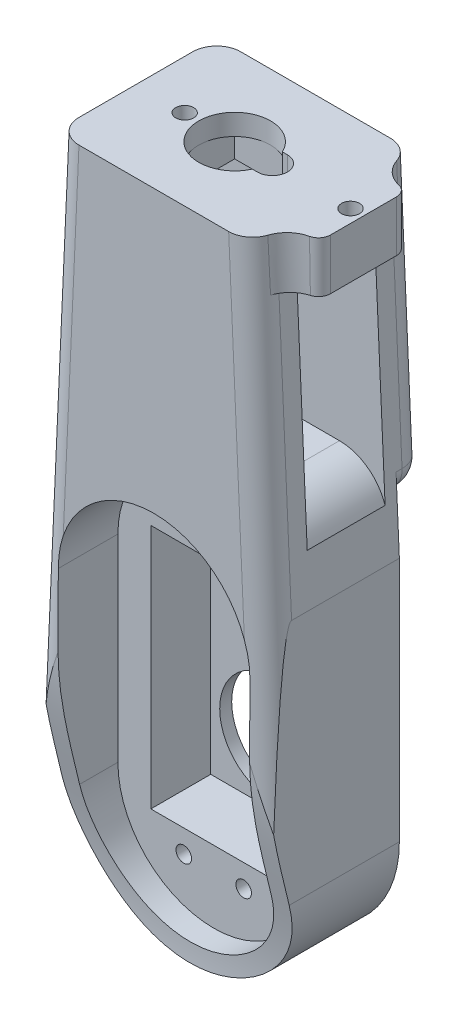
SolidWorks part; units mm, degrees
ref_plane "前视基准面" through (0, 0, 0) normal (0, 0, 1) x (1, 0, 0)
ref_plane "上视基准面" through (0, 0, 0) normal (0, 1, 0) x (1, 0, 0)
ref_plane "右视基准面" through (0, 0, 0) normal (1, 0, 0) x (0, 0, -1)
imported_body "输入1"
sketch "草图1" plane through (0, 0, 19) normal (0, 0, 1) x (1, 0, 0)
  line L1 (9.5445, 46.7241) -> (-8.7751, 46.7241)
  line L2 (9.5445, 46.7241) -> (9.5445, 16.1197)
  line L3 (9.5445, 16.1197) -> (-8.7751, 16.1197)
  line L4 (-8.7751, 46.7241) -> (-8.7751, 16.1197)
  line L5 (9.5445, 46.7241) -> (-8.7751, 16.1197) construction
  line L6 (9.5445, 16.1197) -> (-8.7751, 46.7241) construction
  point P4 (0.3847, 31.4219)
extrude "凸台-拉伸1" add sketch "草图1" against normal up to surface (7 mm away)
sketch "草图2" plane through (0, 46.5, 0) normal (0, -1, 0) x (1, 0, 0)
  circle A0 centre (19, 5.5) radius 2.024
  circle A1 centre (-8.5, 5.5) radius 2.0269
extrude "凸台-拉伸2" add sketch "草图2" against normal up to surface (8.5 mm away)
hole_wizard "M2 螺纹孔1" positions "草图3" profile "草图4" tap size "M2" standard "GB"
sketch "草图3" plane through (0, 55, 0) normal (0, 1, 0) x (1, 0, 0)
  point P0 (-8.35, -5.5)
  point P3 (19.35, -5.5)
sketch "草图4" plane through (-8.35, 55, 5.5) normal (1, 0, 0) x (0, 0, 1)
  line L0 (0, 0) -> (0, 20.4807)
  line L1 (0, 20.4807) -> (0.8, 20)
  line L2 (0.8, 20) -> (0.8, 0)
  line L5 (0.8, 0) -> (0, 0)
  line L10 (0, 20.4807) -> (-0.8, 20) construction
  line L11 (0, -6.35) -> (0, 107.95) construction
  dimension "螺纹孔钻头直径" = 1.6
  dimension "螺纹孔钻头深度" = 20
  dimension "导头角度" = 118
sketch "草图5" plane through (0, 55, 0) normal (0, 1, 0) x (1, 0, 0)
  circle A0 centre (-8.35, -5.5) radius 1.5
  circle A1 centre (19.35, -5.5) radius 1.5
  dimension "D1" = 3
  dimension "D2" = 3
extrude "切除-拉伸1" cut sketch "草图5" against normal blind 3
sketch "草图6" plane through (0, 46.5, 0) normal (0, -1, 0) x (-1, 0, 0)
  line L0 (-16.5, -11.4993) -> (-0.0905, -11.4993) construction
  line L1 (-16.5, 0.5) -> (-17.5, 0.5)
  line L2 (-16.5, 0.5) -> (-16.5, -11.4993)
  line L3 (-16.5, -11.4993) -> (-17.5, -11.4993)
  line L4 (-17.5, 0.5) -> (-17.5, -11.4993)
  line L5 (-16.5, 0.5) -> (-17.5, -11.4993) construction
  line L6 (-16.5, -11.4993) -> (-17.5, 0.5) construction
  point P4 (-17, -5.4997)
  dimension "D1" = 1
extrude "切除-拉伸2" cut sketch "草图6" against normal up to surface (5 mm away)
other "移动面1" parameters "D1"=2
other "移动面2" parameters "D1"=0.3
other "移动面3" parameters "D1"=0.3
sketch "草图7" plane through (0, 0, 9) normal (0, 0, 1) x (1, 0, 0)
  circle A0 centre (5, -0.2) radius 1.3 construction
  circle A1 centre (-5, -0.2) radius 1.3 construction
  circle A2 centre (5, -48.8) radius 1.3 construction
  circle A3 centre (-5, -48.8) radius 1.3 construction
  circle A4 centre (5, -0.2) radius 1.3
  circle A5 centre (-5, -0.2) radius 1.3
  circle A6 centre (5, -48.8) radius 1.3
  circle A7 centre (-5, -48.8) radius 1.3
extrude "切除-拉伸3" cut sketch "草图7" against normal blind 33
fillet "圆角1" radius 5 1 edges at (16.6932, 50.75, -2)
fillet "圆角2" radius 5 1 edges at (16.6932, 50.75, 13)
